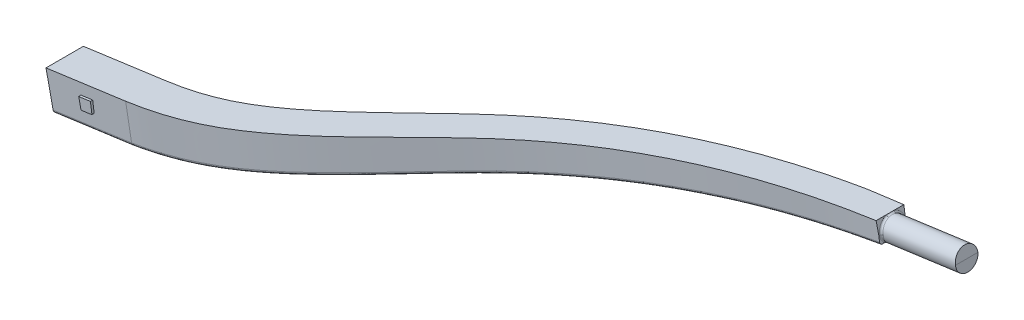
SolidWorks part; units mm, degrees
ref_plane "Plan de face" through (0, 0, 0) normal (0, 0, 1) x (1, 0, 0)
ref_plane "Plan de dessus" through (0, 0, 0) normal (0, 1, 0) x (1, 0, 0)
ref_plane "Plan de droite" through (0, 0, 0) normal (1, 0, 0) x (0, 0, -1)
imported_body "Importée3"
sketch "Esquisse1" plane through (11.9573, 1.6459, 0) normal (-0.9907, -0.1364, 0) x (0, 0, 1)
  line L0 (-4.2302, -2.2273) -> (-4.3, -0.2273)
  line L1 (-4.3, -0.2273) -> (-2.3, -0.2273)
  line L2 (-2.3, -0.2273) -> (-2.3648, -2.0825)
  line L3 (-2.5147, -2.2273) -> (-2.7698, -2.2273)
  line L4 (-2.7698, -2.2273) -> (-2.8222, -0.7273)
  line L5 (-2.8222, -0.7273) -> (-3.8302, -0.7273)
  line L6 (-3.8302, -0.7273) -> (-3.8302, -2.2273)
  line L7 (-3.8302, -2.2273) -> (-4.2302, -2.2273)
  arc A0 (-2.3648, -2.0825) -> (-2.5147, -2.2273) centre (-2.5147, -2.0773) cw
extrude "Boss.-Extru.1" add sketch "Esquisse1" along normal blind 1.7843
ref_plane "Plan1" through (-0.0103, 0.075, -2.1685) normal (0.0048, -0.0346, 0.9994) x (0.9907, 0.1364, 0)
sketch "Esquisse2" plane through (-0.0103, 0.075, -2.1685) normal (0.0048, -0.0346, 0.9994) x (0.9907, 0.1364, 0)
  line L0 (11.9996, -0.9036) -> (12.0205, -1.5039)
  line L1 (12.0205, -1.5039) -> (12.6113, -1.5039)
  line L2 (12.6113, -1.5039) -> (12.6323, -0.9036)
  line L3 (12.6323, -0.9036) -> (11.9996, -0.9036)
extrude "Boss.-Extru.2" add sketch "Esquisse2" against normal up to next
ref_plane "Plan2" through (0.0211, -0.153, -4.4235) normal (0.0048, -0.0346, -0.9994) x (0.9907, 0.1364, 0)
sketch "Esquisse3" plane through (0.0211, -0.153, -4.4235) normal (0.0048, -0.0346, -0.9994) x (0.9907, 0.1364, 0)
  line L0 (12.0205, 1.2736) -> (11.9996, 0.6732)
  line L1 (11.9996, 0.6732) -> (12.6323, 0.6732)
  line L2 (12.6323, 0.6732) -> (12.6113, 1.2736)
  line L3 (12.6113, 1.2736) -> (12.0205, 1.2736)
extrude "Boss.-Extru.3" add sketch "Esquisse3" against normal up to next
draft "Dépouille1" type of draft neutral plane draft angle 2 faces to draft 2 parameters "D1"=2
ref_plane "Plan3" through (12.2009, 1.6794, 0) normal (-0.9907, -0.1364, 0) x (0.1364, -0.9907, 0)
sketch "Esquisse4" plane through (12.2009, 1.6794, 0) normal (-0.9907, -0.1364, 0) x (0.1364, -0.9907, 0)
  line L0 (1.4273, -3.8022) -> (1.4273, -2.7978)
rib "Nervure1" sketch "Esquisse4" sketch "Esquisse4" thickness 0.9581 extrusion direction parallel to sketch draft on yes draft angle 2 parameters "D1"=0.9581, "D3"=2
fillet "Congé variable1" radius 0.1 5 edges at (43.5894, 4.6414, -13.1238) (44.2413, 4.9519, -12.9603) (43.7664, 4.6705, -13.9017) (44.108, 5.782, -13.51) (44.2413, 4.9518, -14.0597)
fillet "Congé3" radius 0.15 3 edges at (12.5887, -0.5154, -4.2302) (17.913, 0.3172, -4.6179)
fillet "Congé4" radius 0.305 13 edges at (20.9276, 2.1466, -5.5151) (21.0904, 2.169, -4.6008) (11.0191, 0.7826, -2.8222) (11.0191, 0.7826, -3.7778) (13.6392, 1.1433, -3.7778) (13.6392, 1.1433, -2.8222)
